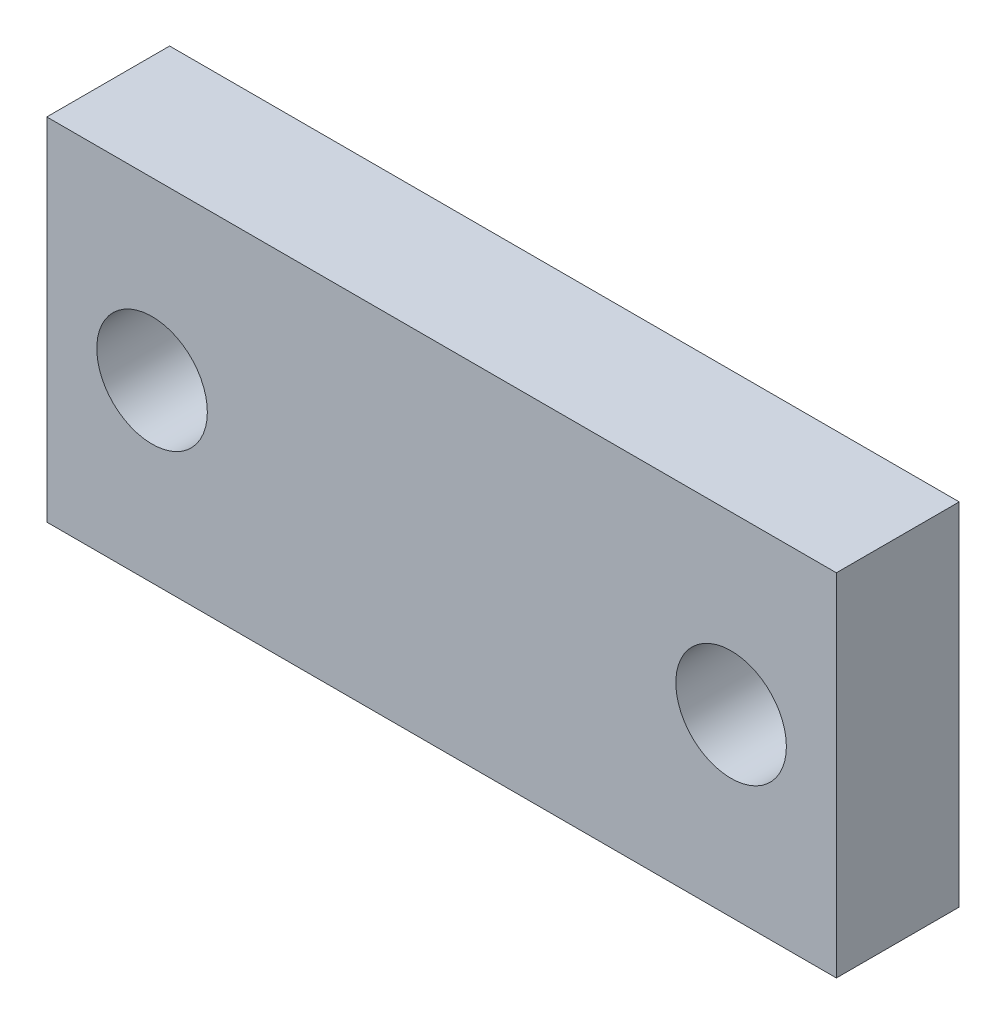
SolidWorks part; units mm, degrees
ref_plane "Plan de face" through (0, 0, 0) normal (0, 0, 1) x (1, 0, 0)
ref_plane "Plan de dessus" through (0, 0, 0) normal (0, 1, 0) x (1, 0, 0)
ref_plane "Plan de droite" through (0, 0, 0) normal (1, 0, 0) x (0, 0, -1)
sketch "Esquisse1" plane through (0, 0, 0) normal (0, 0, 1) x (1, 0, 0)
  line L1 (0, 0) -> (45, 0)
  line L2 (0, 0) -> (0, -20)
  line L3 (0, -20) -> (45, -20)
  line L4 (45, 0) -> (45, -20)
  dimension "D1" = 45
  dimension "D2" = 20
extrude "Boss.-Extru.1" add sketch "Esquisse1" along normal blind 7
sketch "Esquisse2" plane through (0, 0, 7) normal (0, 0, 1) x (1, 0, 0)
  line L1 (45, -20) -> (45, 0) construction
  line L2 (45, 0) -> (0, 0) construction
  line L3 (0, 0) -> (0, -20) construction
  circle A0 centre (6, -10) radius 3.15
  circle A1 centre (39, -10) radius 3.15
  dimension "D1" = 6.3
  dimension "D2" = 6
  dimension "D3" = 10
  dimension "D4" = 6
extrude "Enlèv. mat.-Extru.1" cut sketch "Esquisse2" against normal blind 7
